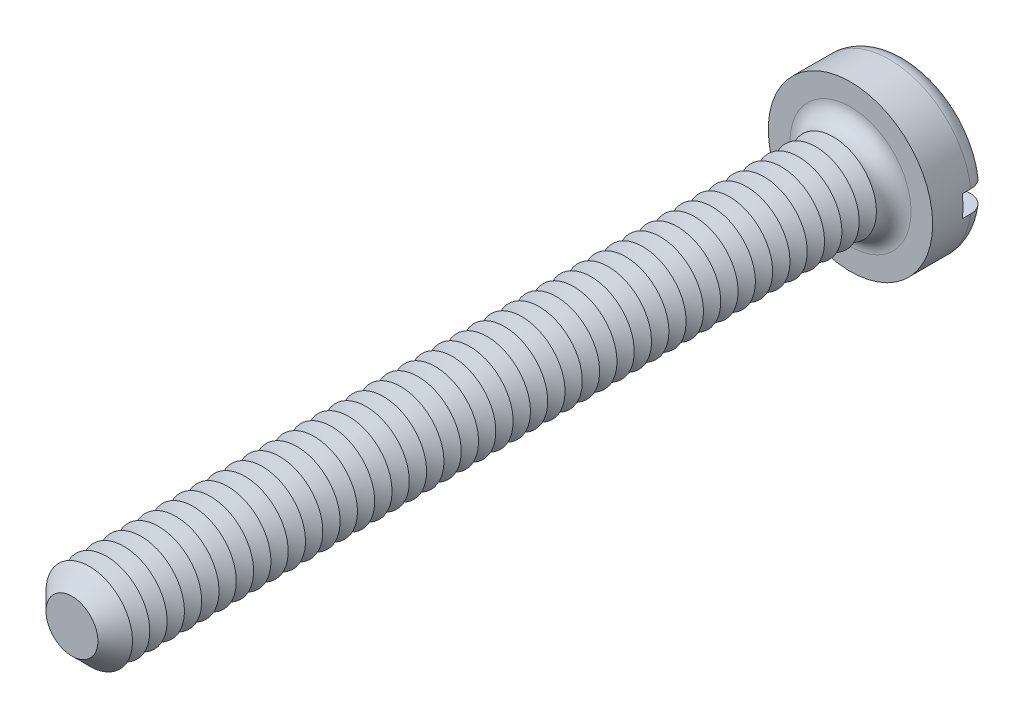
SolidWorks part; units mm, degrees
ref_plane "Front Plane" through (0, 0, 0) normal (0, 0, 1) x (1, 0, 0)
ref_plane "Top Plane" through (0, 0, 0) normal (0, 1, 0) x (1, 0, 0)
ref_plane "Right Plane" through (0, 0, 0) normal (1, 0, 0) x (0, 0, -1)
sketch "Sketch3" plane through (0, 0, 0) normal (0, 0, 1) x (1, 0, 0)
  circle A0 centre (0, 0) radius 1.9
  dimension "D1" = 3.8
extrude "Boss-Extrude2" add sketch "Sketch3" against normal blind 1.3
sketch "Sketch4" plane through (0, 0, 0) normal (0, 0, 1) x (1, 0, 0)
  circle A0 centre (0, 0) radius 1
  dimension "D1" = 2
extrude "Boss-Extrude3" add sketch "Sketch4" along normal blind 18
fillet "Fillet1" radius 0.4 2 edges at (1.9, 0, -1.3) (1, 0, 0)
chamfer "Chamfer1" distance 0.4 angle 45 1 edges at (1, 0, 18)
sketch "Sketch5" plane through (0, 0, 0) normal (1, 0, 0) x (0, 0, -1)
  line L0 (1.6944, 0) -> (-7.6738, 0) construction
sketch "Sketch6" plane through (0, 0, 0) normal (1, 0, 0) x (0, 0, -1)
  line L0 (-0.4, 1) -> (-0.6, 0.6536)
  line L1 (-0.6, 0.6536) -> (-0.8, 1)
  line L2 (-0.4, 1) -> (-17.6, 1) construction
  line L3 (-0.8, 1) -> (-0.4, 1)
  dimension "D1" = 0.4
revolve "Cut-Revolve1" cut sketch "Sketch6" angle 360 about L0
pattern_linear "LPattern1" count 43 spacing 0.4 along (0, 0, 1) of "Cut-Revolve1"
sketch "Sketch8" plane through (0, 0, -1.3) normal (0, 0, -1) x (-1, 0, 0)
  line L1 (1.9, -0.25) -> (-1.9, -0.25)
  line L2 (1.9, -0.25) -> (1.9, 0.25)
  line L3 (1.9, 0.25) -> (-1.9, 0.25)
  line L4 (-1.9, -0.25) -> (-1.9, 0.25)
  line L5 (1.9, -0.25) -> (-1.9, 0.25) construction
  line L6 (1.9, 0.25) -> (-1.9, -0.25) construction
  point P0 (0, 0)
  dimension "D1" = 3.8
  dimension "D2" = 0.5
extrude "Cut-Extrude1" cut sketch "Sketch8" against normal blind 0.6
